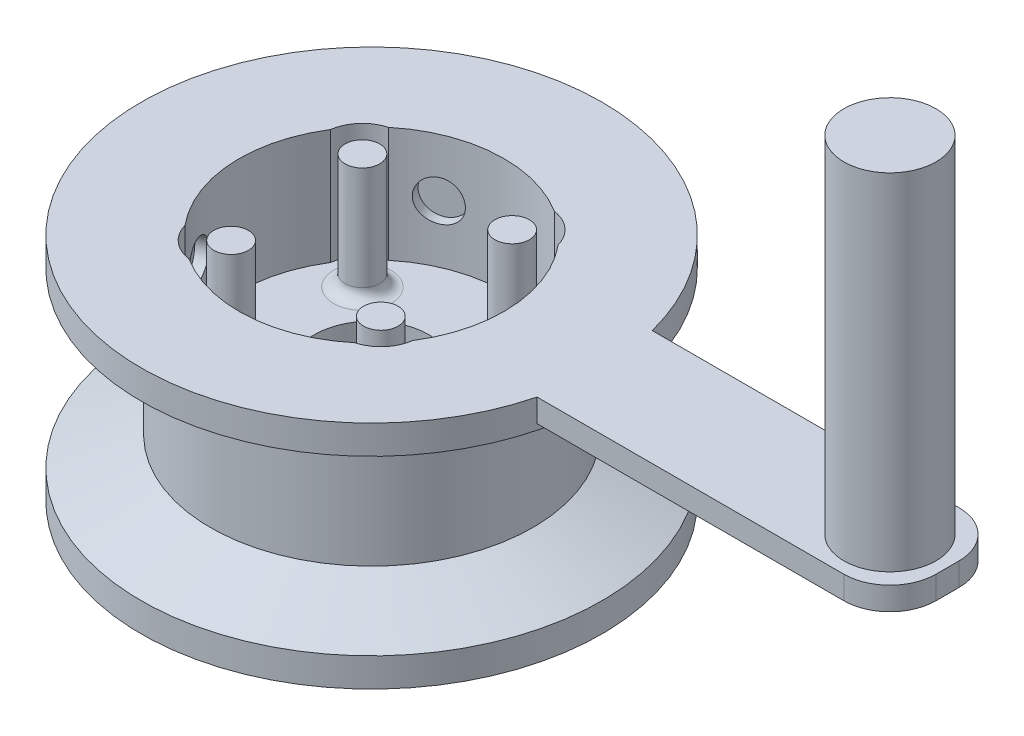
SolidWorks part; units mm, degrees
ref_plane "Front Plane" through (0, 0, 0) normal (0, 0, 1) x (1, 0, 0)
ref_plane "Top Plane" through (0, 0, 0) normal (0, 1, 0) x (1, 0, 0)
ref_plane "Right Plane" through (0, 0, 0) normal (1, 0, 0) x (0, 0, -1)
sketch "Sketch1" plane through (0, 0, 0) normal (1, 0, 0) x (0, 0, -1)
  line L0 (0, 0) -> (0, 101.0544) construction
  line L1 (-29.21, 0) -> (-50.8, 0)
  line L2 (-50.8, 0) -> (-50.8, 6.35)
  line L3 (-50.8, 6.35) -> (-35.56, 12.7)
  line L4 (-35.56, 12.7) -> (-35.56, 38.1)
  line L5 (-35.56, 38.1) -> (-50.8, 44.45)
  line L6 (-50.8, 44.45) -> (-50.8, 50.8)
  line L7 (-50.8, 50.8) -> (-29.21, 50.8)
  line L8 (-29.21, 50.8) -> (-29.21, 0)
  dimension "D1" = 58.42
  dimension "D2" = 50.8
  dimension "D3" = 6.35
  dimension "D4" = 25.4
  dimension "D5" = 6.35
  dimension "D6" = 101.6
revolve "Revolve1" add sketch "Sketch1" angle 360 about L0
sketch "Sketch2" plane through (0, 0, 0) normal (0, -1, 0) x (-1, 0, 0)
  circle A0 centre (0, 0) radius 29.21
  circle A1 centre (0, 0) radius 12.7
  circle A2 centre (0, 0) radius 29.21 construction
  dimension "D1" = 25.4
extrude "Boss-Extrude1" add sketch "Sketch2" against normal blind 25.4
sketch "Sketch3" plane through (0, 25.4, 0) normal (0, 1, 0) x (1, 0, 0)
  line L0 (-16.51, 10.668) -> (0, 10.668) construction
  circle A0 centre (-16.51, 14.478) radius 3.81
  dimension "D1" = 7.62
  dimension "D2" = 10.668
  dimension "D3" = 16.51
extrude "Boss-Extrude2" add sketch "Sketch3" along normal blind 25.4
pattern_circular "CirPattern1" count 4 over 360 about axis through (0, 0, 0) along (0, 1, 0) of "Boss-Extrude2"
sketch "Sketch4" plane through (0, 50.8, 0) normal (0, 1, 0) x (1, 0, 0)
  line L1 (31.75, 12.7) -> (116.84, 12.7)
  line L2 (31.75, 12.7) -> (31.75, -12.7)
  line L3 (31.75, -12.7) -> (116.84, -12.7)
  line L4 (127, 2.54) -> (127, -2.54)
  arc A1 (116.84, -12.7) -> (127, -2.54) centre (116.84, -2.54) ccw
  arc A2 (127, 2.54) -> (116.84, 12.7) centre (116.84, 2.54) ccw
  point P8 (127, -12.7)
  point P11 (127, 12.7)
  dimension "D5" = 10.16
  dimension "D1" = 25.4
  dimension "D2" = 12.7
  dimension "D3" = 31.75
  dimension "D4" = 127
extrude "Boss-Extrude3" add sketch "Sketch4" against normal blind 5.08
sketch "Sketch5" plane through (0, 50.8, 0) normal (0, 1, 0) x (1, 0, 0)
  line L0 (127, -2.54) -> (127, 2.54) construction
  circle A0 centre (114.3, 0) radius 10.16
  point P4 (127, 0)
  dimension "D2" = 20.32
  dimension "D1" = 12.7
extrude "Boss-Extrude4" add sketch "Sketch5" along normal blind 76.2
fillet "Fillet1" radius 2.54 4 edges at (-14.478, 25.4, 12.7) (16.51, 25.4, 10.668) (14.478, 25.4, -20.32) (-16.51, 25.4, -18.288)
sketch "Sketch8" plane through (0, 50.8, 0) normal (0, 1, 0) x (1, 0, 0)
  line L0 (-16.51, 14.478) -> (-10.6961, 17.0317) construction
  line L1 (-10.6961, 17.0317) -> (-14.3823, 25.4239) construction
  circle A0 centre (0, 0) radius 29.21 construction
  circle A1 centre (0, 0) radius 29.21 construction
  dimension "D1" = 6.35
  dimension "D2" = 5.8139
ref_plane "Plane1" through (-8.001, 0, -18.2155) normal (-0.4022, 0, -0.9156) x (-0.9156, 0, 0.4022)
ref_plane "Plane2" through (-10.044, 0, -22.8666) normal (-0.4022, 0, -0.9156) x (-0.9156, 0, 0.4022)
sketch "Sketch10" plane through (-10.044, 0, -22.8666) normal (-0.4022, 0, -0.9156) x (-0.9156, 0, 0.4022)
  line L0 (9.2937, 50.8) -> (2.9437, 50.8) construction
  circle A0 centre (0, 38.1) radius 4.445
  dimension "D2" = 8.89
  dimension "D1" = 12.7
extrude "Cut-Extrude3" cut sketch "Sketch10" along normal blind 6.35
pattern_circular "CirPattern2" count 4 over 360 about axis through (0, 0, 0) along (0, 1, 0) of "Cut-Extrude3"
sketch "Sketch11" plane through (0, 50.8, 0) normal (0, 1, 0) x (1, 0, 0)
  arc A0 (-18.7042, 22.436) -> (-24.6864, 15.6142) centre (-16.51, 14.478) ccw
  circle A1 centre (-16.51, 14.478) radius 3.81 construction
  arc A2 (-18.7042, 22.436) -> (-24.6864, 15.6142) centre (0, 0) ccw
  circle A3 centre (0, 0) radius 29.21 construction
  dimension "D1" = 16.51
extrude "Cut-Extrude4" cut sketch "Sketch11" against normal up to surface (25.4 mm away)
pattern_circular "CirPattern3" count 4 over 360 about axis through (0, 0, 0) along (0, 1, 0) of "Cut-Extrude4"
